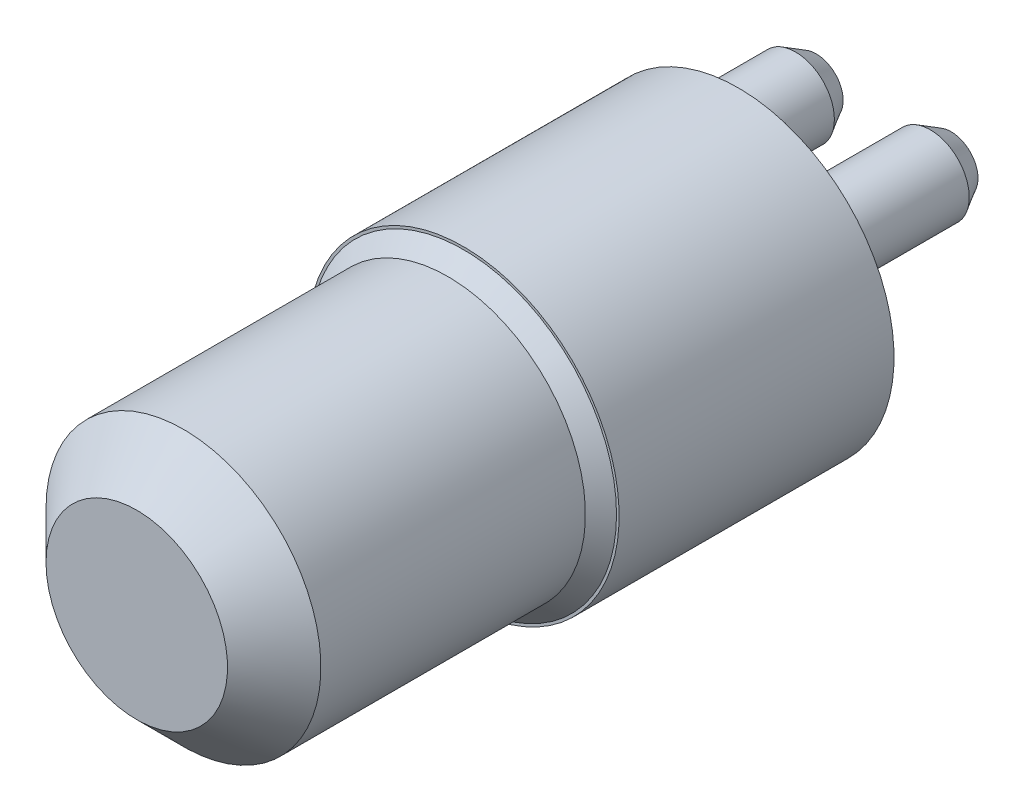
SolidWorks part; units mm, degrees
ref_plane "Front Plane" through (0, 0, 0) normal (0, 0, 1) x (1, 0, 0)
ref_plane "Top Plane" through (0, 0, 0) normal (0, 1, 0) x (1, 0, 0)
ref_plane "Right Plane" through (0, 0, 0) normal (1, 0, 0) x (0, 0, -1)
sketch "Sketch1" plane through (0, 0, 0) normal (0, 0, 1) x (1, 0, 0)
  circle A0 centre (0, 0) radius 7.62
  dimension "D1" = 15.24
extrude "base" add sketch "Sketch1" along normal blind 13.462
sketch "Sketch2" plane through (0, 0, 13.462) normal (0, 0, 1) x (1, 0, 0)
  circle A0 centre (0, 0) radius 6.731
  dimension "D1" = 13.462
extrude "motor" add sketch "Sketch2" along normal blind 16.002
chamfer "Chamfer1" distance 2.286 angle 45 1 edges at (6.731, 0, 29.464)
sketch "Sketch3" plane through (0, 0, 0) normal (0, 0, -1) x (-1, 0, 0)
  line L0 (0, 0) -> (0, 7.62) construction
  circle A0 centre (0, 0) radius 7.62 construction
  circle A1 centre (-3.302, 2.54) radius 1.905
  circle A2 centre (3.302, 2.54) radius 1.905
  dimension "D1" = 3.81
  dimension "D2" = 3.302
  dimension "D3" = 2.54
extrude "hose_barb" add sketch "Sketch3" along normal blind 7.112
chamfer "Chamfer2" distance 0.762 angle 45 1 edges at (6.731, 0, 13.462)
chamfer "Chamfer4" distance 1.016 angle 30 2 edges at (-1.397, 2.54, -7.112) (1.397, 2.54, -7.112)
